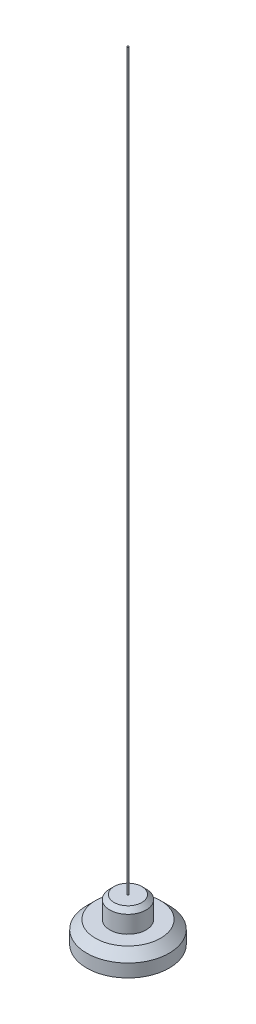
SolidWorks part; units mm, degrees
ref_plane "Front Plane" through (0, 0, 0) normal (0, 0, 1) x (1, 0, 0)
ref_plane "Top Plane" through (0, 0, 0) normal (0, 1, 0) x (1, 0, 0)
ref_plane "Right Plane" through (0, 0, 0) normal (1, 0, 0) x (0, 0, -1)
sketch "Sketch1" plane through (0, 0, 0) normal (0, 1, 0) x (1, 0, 0)
  circle A0 centre (0, 0) radius 24.257
extrude "Extrude1" add sketch "Sketch1" along normal blind 12.7
chamfer "Chamfer1" distance 5.08 angle 45 1 edges at (0, 12.7, 24.257)
sketch "Sketch2" plane through (0, 12.7, 0) normal (0, 1, 0) x (-1, 0, 0)
  circle A0 centre (0, 0) radius 10.6919
extrude "Extrude2" add sketch "Sketch2" along normal blind 12.7 separate body
chamfer "Chamfer2" distance 2.54 angle 45 1 edges at (0, 25.4, 10.6919)
sketch "Sketch3" plane through (0, 25.4, 0) normal (0, 1, 0) x (-1, 0, 0)
  circle A0 centre (0, 0) radius 0.508
extrude "Extrude3" add sketch "Sketch3" along normal blind 431.8
